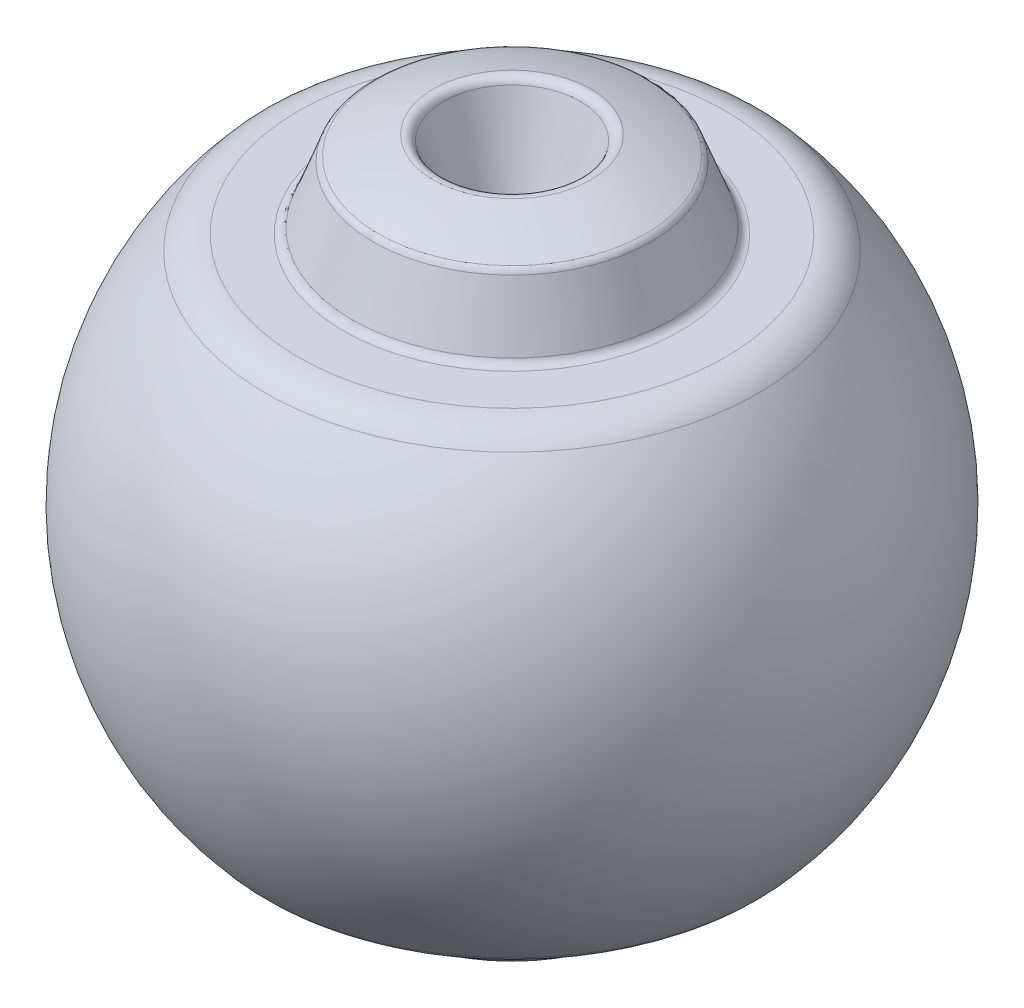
SolidWorks part; units mm, degrees
ref_plane "Front Plane" through (0, 0, 0) normal (0, 0, 1) x (1, 0, 0)
ref_plane "Top Plane" through (0, 0, 0) normal (0, 1, 0) x (1, 0, 0)
ref_plane "Right Plane" through (0, 0, 0) normal (1, 0, 0) x (0, 0, -1)
sketch "Sketch1" plane through (0, 0, 0) normal (0, 0, 1) x (1, 0, 0)
  line L0 (0, 26.5943) -> (0, -26.5943)
  line L1 (0, 0) -> (37.5, 0) construction
  line L2 (37.5, 0) -> (37.5, -44.45) construction
  line L3 (37.5, 0) -> (35.2986, -42.0057) construction
  line L4 (15.6328, -34.0862) -> (18.4385, -26.5943)
  line L5 (18.4385, -26.5943) -> (26.4385, -26.5943)
  line L6 (18.4385, 26.5943) -> (26.4385, 26.5943)
  line L7 (15.6328, 34.0862) -> (18.4385, 26.5943)
  line L8 (8.0848, -36.6181) -> (4.4365, -26.5943)
  line L9 (4.4365, -26.5943) -> (0, -26.5943)
  line L10 (8.0848, 36.6181) -> (4.4365, 26.5943)
  line L11 (4.4365, 26.5943) -> (0, 26.5943)
  arc A0 (8.0848, 36.6181) -> (15.6328, 34.0862) centre (0, 0) cw
  arc A1 (15.6328, -34.0862) -> (8.0848, -36.6181) centre (0, 0) cw
  arc A2 (15.6328, 34.0862) -> (8.0848, 36.6181) centre (0, 0) ccw
  arc A3 (26.4385, 26.5943) -> (26.4385, -26.5943) centre (0, 0) cw
  dimension "D1" = 37.5
  dimension "D2" = 3
  dimension "D3" = 110
  dimension "D4" = 8
  dimension "D5" = 14.002
  dimension "D6" = 4.4365
  dimension "D7" = 10.0238
revolve "Revolve1" add sketch "Sketch1" angle 360 about L0
fillet "Fillet1" radius 1 8 edges at (-18.4385, -26.5943, 0) (-15.6328, -34.0862, 0) (-8.0848, -36.6181, 0) (-4.4365, -26.5943, 0) (-4.4365, 26.5943, 0) (-8.0848, 36.6181, 0) (-15.6328, 34.0862, 0) (-18.4385, 26.5943, 0)
fillet "Fillet2" radius 5 2 edges at (-26.4385, 26.5943, 0) (-26.4385, -26.5943, 0)
